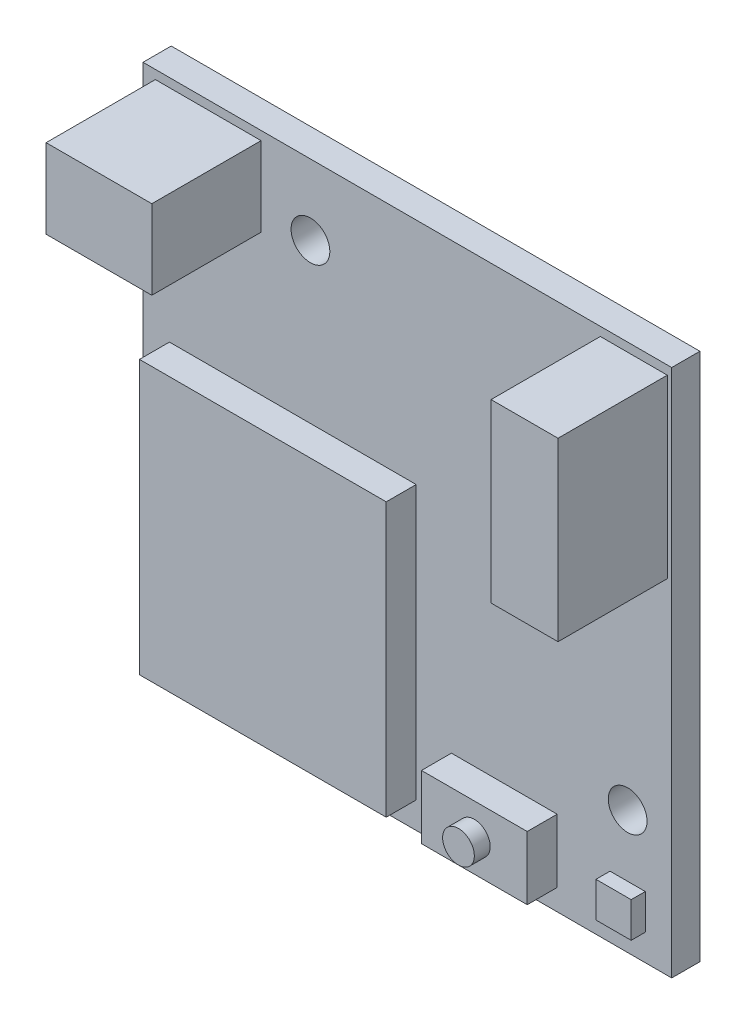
SolidWorks part; units mm, degrees
ref_plane "Ebene vorne" through (0, 0, 0) normal (0, 0, 1) x (1, 0, 0)
ref_plane "Ebene oben" through (0, 0, 0) normal (0, 1, 0) x (1, 0, 0)
ref_plane "Ebene rechts" through (0, 0, 0) normal (1, 0, 0) x (0, 0, -1)
sketch "Skizze1" plane through (0, 0, 0) normal (0, 0, 1) x (1, 0, 0)
  line L1 (-15, -15) -> (15, -15)
  line L2 (-15, -15) -> (-15, 15)
  line L3 (-15, 15) -> (15, 15)
  line L4 (15, -15) -> (15, 15)
  line L5 (-15, -15) -> (15, 15) construction
  line L6 (-15, 15) -> (15, -15) construction
  point P0 (0, 0)
  dimension "D1" = 30
  dimension "D2" = 30
extrude "Grundplatine" add sketch "Skizze1" along normal blind 1.6
sketch "Skizze2" plane through (0, 0, 1.6) normal (0, 0, 1) x (1, 0, 0)
  line L0 (-15, 15) -> (-15, -15) construction
  line L1 (15, 15) -> (-15, 15) construction
  line L2 (15, -15) -> (15, 15) construction
  line L3 (-15, -15) -> (15, -15) construction
  circle A0 centre (-5.5, 11) radius 1.1
  circle A1 centre (12.5, -8) radius 1.1
  dimension "D1" = 2.2
  dimension "D2" = 9.5
  dimension "D3" = 4
  dimension "D4" = 2.5
  dimension "D5" = 7
extrude "Bohrungen" cut sketch "Skizze2" against normal through all
sketch "Skizze3" plane through (0, 0, 1.6) normal (0, 0, 1) x (1, 0, 0)
  line L0 (15, -15) -> (15, 15) construction
  line L1 (2.5, -10.2) -> (8.5, -10.2)
  line L2 (2.5, -10.2) -> (2.5, -13.8)
  line L3 (2.5, -13.8) -> (8.5, -13.8)
  line L4 (8.5, -10.2) -> (8.5, -13.8)
  line L5 (-15, -15) -> (15, -15) construction
  dimension "D1" = 6
  dimension "D2" = 3.6
  dimension "D3" = 6.5
  dimension "D4" = 1.2
extrude "Taster" add sketch "Skizze3" along normal blind 1.7
sketch "Skizze4" plane through (0, 0, 3.3) normal (0, 0, 1) x (1, 0, 0)
  line L0 (5.5, -10.2) -> (5.5, -13.8) construction
  line L1 (8.5, -10.2) -> (2.5, -10.2) construction
  line L2 (2.5, -13.8) -> (8.5, -13.8) construction
  line L3 (5.5, -12) -> (8.5, -12) construction
  line L4 (8.5, -13.8) -> (8.5, -10.2) construction
  circle A0 centre (5.5, -12) radius 0.9
  dimension "D1" = 1.8
extrude "Tasterknopf" add sketch "Skizze4" along normal blind 0.9
sketch "Skizze5" plane through (0, 0, 1.6) normal (0, 0, 1) x (1, 0, 0)
  line L0 (15, -15) -> (15, 15) construction
  line L1 (11.5, -11.5) -> (13.5, -11.5)
  line L2 (11.5, -11.5) -> (11.5, -13.5)
  line L3 (11.5, -13.5) -> (13.5, -13.5)
  line L4 (13.5, -11.5) -> (13.5, -13.5)
  line L5 (-15, -15) -> (15, -15) construction
  dimension "D1" = 2
  dimension "D2" = 2
  dimension "D3" = 1.5
  dimension "D4" = 1.5
extrude "LED" add sketch "Skizze5" along normal blind 0.8
sketch "Skizze6" plane through (0, 0, 1.6) normal (0, 0, 1) x (1, 0, 0)
  line L0 (-15, 15) -> (-15, -15) construction
  line L1 (-13.5, 2) -> (0.5, 2)
  line L2 (-13.5, 2) -> (-13.5, -13.5)
  line L3 (-13.5, -13.5) -> (0.5, -13.5)
  line L4 (0.5, 2) -> (0.5, -13.5)
  line L5 (-15, -15) -> (15, -15) construction
  dimension "D1" = 14
  dimension "D2" = 15.5
  dimension "D3" = 1.5
  dimension "D4" = 1.5
extrude "SD-Slot" add sketch "Skizze6" along normal blind 1.7
sketch "Skizze7" plane through (0, 0, 1.6) normal (0, 0, 1) x (1, 0, 0)
  line L0 (15, -15) -> (15, 15) construction
  line L1 (-14.3, 14.5) -> (-8.3, 14.5)
  line L2 (-14.3, 14.5) -> (-14.3, 10)
  line L3 (-14.3, 10) -> (-8.3, 10)
  line L4 (-8.3, 14.5) -> (-8.3, 10)
  line L5 (10.95, 14.5) -> (14.75, 14.5)
  line L6 (10.95, 14.5) -> (10.95, 4.5)
  line L7 (10.95, 4.5) -> (14.75, 4.5)
  line L8 (14.75, 14.5) -> (14.75, 4.5)
  line L9 (15, 15) -> (-15, 15) construction
  line L10 (-15, 15) -> (-15, -15) construction
  dimension "D1" = 6
  dimension "D2" = 4.5
  dimension "D3" = 3.8
  dimension "D4" = 10
  dimension "D5" = 0.25
  dimension "D6" = 0.5
  dimension "D7" = 0.5
  dimension "D8" = 0.7
extrude "Anschlüsse" add sketch "Skizze7" along normal blind 6.2
